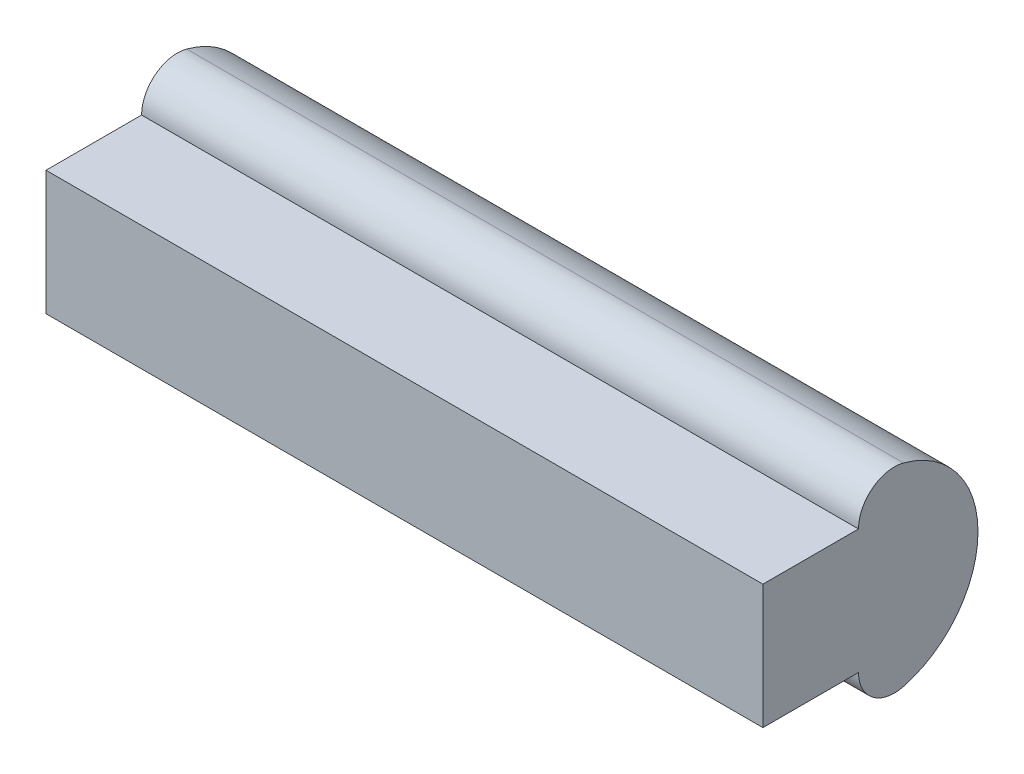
SolidWorks part; units mm, degrees
ref_plane "Alzado" through (0, 0, 0) normal (0, 0, 1) x (1, 0, 0)
ref_plane "Planta" through (0, 0, 0) normal (0, 1, 0) x (1, 0, 0)
ref_plane "Vista lateral" through (0, 0, 0) normal (1, 0, 0) x (0, 0, -1)
sketch "Croquis1" plane through (0, 0, 0) normal (1, 0, 0) x (0, 0, -1)
  line L0 (40, 26) -> (40, -26)
  line L1 (0, -26) -> (0, 26)
  line L8 (40, -26) -> (0, -26)
  line L9 (40, 26) -> (0, 26)
  arc A0 (58.8476, 40.4981) -> (40, 26) centre (55, 26) ccw
  arc A1 (58.8476, -40.4981) -> (40, -26) centre (55, -26) cw
  arc A3 (58.8476, -40.4981) -> (58.8476, 40.4981) centre (48.1, 0) ccw
  point P6 (0, 0)
extrude "Saliente-Extruir1" add sketch "Croquis1" along normal blind 300 contours L0 L9 L1 L8 | A1 A3 A0 L0
